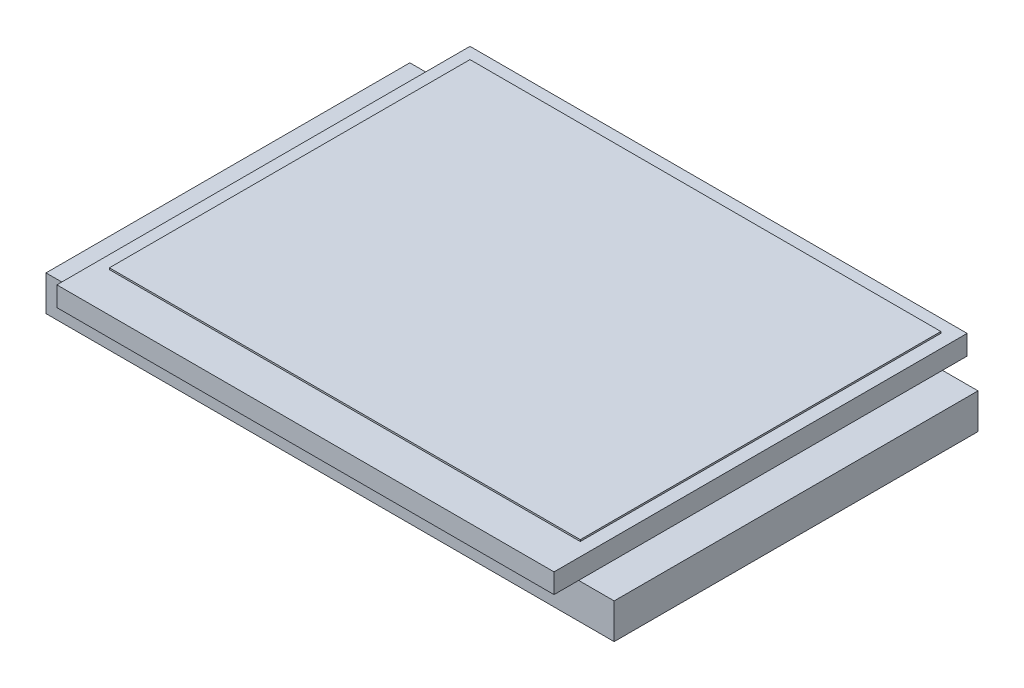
SolidWorks part; units mm, degrees
ref_plane "Front Plane" through (0, 0, 0) normal (0, 0, 1) x (1, 0, 0)
ref_plane "Top Plane" through (0, 0, 0) normal (0, 1, 0) x (1, 0, 0)
ref_plane "Right Plane" through (0, 0, 0) normal (1, 0, 0) x (0, 0, -1)
sketch "Sketch1" plane through (0, 0, 0) normal (0, 1, 0) x (1, 0, 0)
  line L1 (38.45, -31.95) -> (-38.45, -31.95)
  line L2 (38.45, -31.95) -> (38.45, 31.95)
  line L3 (38.45, 31.95) -> (-38.45, 31.95)
  line L4 (-38.45, -31.95) -> (-38.45, 31.95)
  line L5 (38.45, -31.95) -> (-38.45, 31.95) construction
  line L6 (38.45, 31.95) -> (-38.45, -31.95) construction
  point P0 (0, 0)
  dimension "D1" = 63.9
  dimension "D2" = 76.9
extrude "Boss-Extrude1" add sketch "Sketch1" along normal blind 3.048
sketch "Sketch2" plane through (0, 3.048, 0) normal (0, 1, 0) x (1, 0, 0)
  line L0 (38.45, -31.95) -> (38.45, 31.95) construction
  line L1 (-36.418, 29.918) -> (36.418, 29.918)
  line L2 (-36.418, 29.918) -> (-36.418, -25.854)
  line L3 (-36.418, -25.854) -> (36.418, -25.854)
  line L4 (36.418, 29.918) -> (36.418, -25.854)
  line L5 (-36.418, 29.918) -> (36.418, -25.854) construction
  line L6 (-36.418, -25.854) -> (36.418, 29.918) construction
  line L7 (-38.45, 31.95) -> (-38.45, -31.95) construction
  line L8 (38.45, 31.95) -> (-38.45, 31.95) construction
  line L9 (-38.45, -31.95) -> (38.45, -31.95) construction
  point P0 (0, 2.032)
  point P7 (-38.45, 0)
  dimension "D1" = 2.032
  dimension "D2" = 2.032
  dimension "D3" = 2.032
  dimension "D4" = 6.096
extrude "Boss-Extrude2" add sketch "Sketch2" along normal blind 0.254
sketch "Sketch3" plane through (0, 0, 0) normal (0, -1, 0) x (1, 0, 0)
  line L1 (-43.942, 28.14) -> (43.942, 28.14)
  line L2 (-43.942, 28.14) -> (-43.942, -28.14)
  line L3 (-43.942, -28.14) -> (43.942, -28.14)
  line L4 (43.942, 28.14) -> (43.942, -28.14)
  line L5 (-43.942, 28.14) -> (43.942, -28.14) construction
  line L6 (-43.942, -28.14) -> (43.942, 28.14) construction
  line L7 (38.45, -31.95) -> (-38.45, -31.95) construction
  line L8 (-38.45, 31.95) -> (38.45, 31.95) construction
  point P0 (0, 0)
  point P9 (0, 31.95)
  dimension "D1" = 87.884
  dimension "D2" = 3.81
  dimension "D4" = 3.81
extrude "Boss-Extrude3" add sketch "Sketch3" along normal blind 5.461
